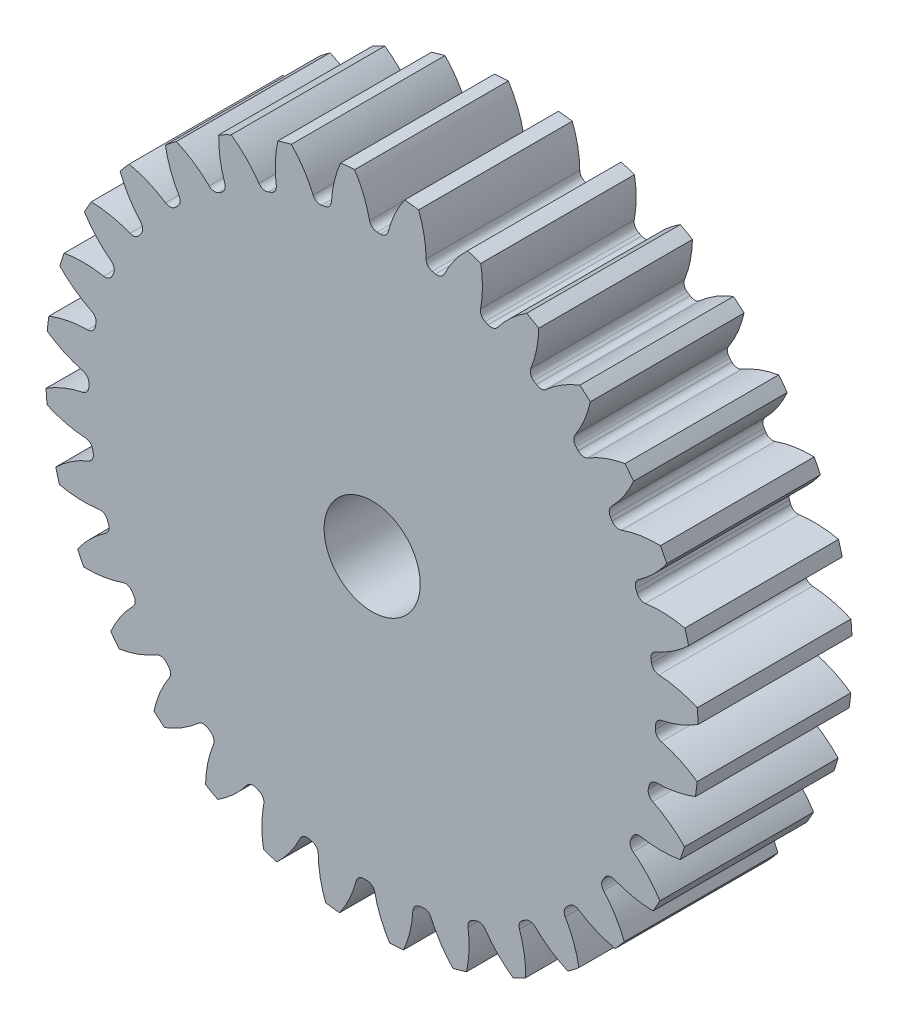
SolidWorks part; units mm, degrees
ref_plane "Front" through (0, 0, 0) normal (0, 0, 1) x (1, 0, 0)
ref_plane "Top" through (0, 0, 0) normal (0, 1, 0) x (1, 0, 0)
ref_plane "Right" through (0, 0, 0) normal (1, 0, 0) x (0, 0, -1)
sketch "Sketch3" plane through (0, 0, 0) normal (0, 0, 1) x (1, 0, 0)
  circle A0 centre (0, 0) radius 215.9
  dimension "od" = 431.8
extrude "gearBody" add sketch "Sketch3" along normal blind 101.6
sketch "Sketch2" plane through (0, 0, 0) normal (0, 0, 1) x (1, 0, 0)
  line L0 (0, 0) -> (176.4107, 73.0717) construction
  line L1 (215.1242, -21.757) -> (0, 0) construction
  line L2 (0, 0) -> (36.3143, 0) construction
  line L3 (203.1324, 5.2408) -> (202.6729, -14.6264) construction
  line L5 (202.9027, -4.6928) -> (0, 0) construction
  line L7 (0, 0) -> (190.9455, 0) construction
  arc A0 (190.9386, 1.6292) -> (190.6591, -10.455) centre (0, 0) ccw construction
  arc A1 (215.5888, 11.5886) -> (214.8225, -21.5434) centre (0, 0) ccw construction
  arc A2 (203.1324, 5.2408) -> (202.6729, -14.6264) centre (0, 0) ccw construction
  arc A3 (187.2466, -5.4188) -> (187.2969, -3.2439) centre (0, 0) ccw
  arc A4 (215.1242, -21.757) -> (191.1177, -10.5722) centre (172.8438, -81.1494) ccw
  arc A5 (215.1242, -21.757) -> (215.9, 11.7881) centre (0, 0) ccw
  arc A6 (215.9, 11.7881) -> (191.4021, 1.7251) centre (176.4107, 73.0717) cw
  arc A7 (187.2969, -3.2439) -> (191.4021, 1.7251) centre (192.465, -3.3334) cw
  arc A8 (191.1177, -10.5722) -> (187.2466, -5.4188) centre (192.4133, -5.5683) cw
  point P6 (215.9, 11.7881)
  point P22 (215.1242, -21.757)
  dimension "baseDia" = 381.8911
  dimension "od" = 431.8
  dimension "pd" = 406.4
  dimension "rd" = 374.65
  dimension "rFillet" = 5.1689
  dimension "pointX" = 215.9
  dimension "pointY" = 11.7881
  dimension "CTT" = 19.8672
  dimension "flankCenterAngle" = 22.5
extrude "toothCut" cut sketch "Sketch2" along normal through all
pattern_circular "CirPattern1" count 32 over 360 about axis through (0, 0, 0) along (0, 0, 1) of "toothCut"
sketch "hub1Dia" plane through (0, 0, 0) normal (0, 0, -1) x (-1, 0, 0)
  circle A0 centre (0, 0) radius 12.7
  dimension "hub1Dia" = 25.4
sketch "hub2Dia" plane through (0, 0, 101.6) normal (0, 0, 1) x (1, 0, 0)
  circle A0 centre (0, 0) radius 12.7
  dimension "hub2dia" = 25.4
sketch "boreDia" plane through (0, 0, 0) normal (0, 0, 1) x (1, 0, 0)
  circle A0 centre (0, 0) radius 31.75
  dimension "boreDia" = 63.5
extrude "bore" cut sketch "boreDia" against normal mid plane 25400
